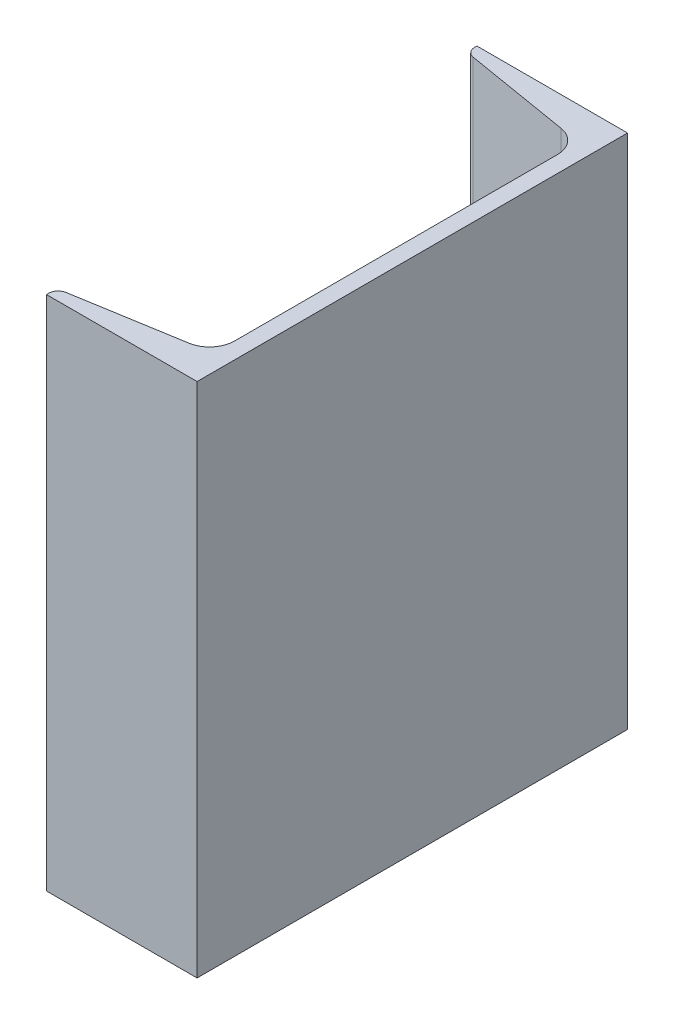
SolidWorks part; units mm, degrees
ref_plane "Front Plane" through (0, 0, 0) normal (0, 0, 1) x (1, 0, 0)
ref_plane "Top Plane" through (0, 0, 0) normal (0, 1, 0) x (1, 0, 0)
ref_plane "Right Plane" through (0, 0, 0) normal (1, 0, 0) x (0, 0, -1)
sketch "Sketch1" plane through (0, 0, 0) normal (0, 0, 1) x (1, 0, 0)
  line L0 (0, 0) -> (0, 152.4)
  dimension "D1" = 152.4
other "Al channel (standard) C5X2.32(1)"
ref_plane "Plane1" through (0, 0, 0) normal (0, 1, 0) x (-1, 0, 0)
sketch "Sketch12" plane through (0, 0, 0) normal (0, 1, 0) x (-1, 0, 0)
  line L0 (0, 0) -> (0, 127)
  line L1 (0, 127) -> (44.45, 127)
  line L2 (0, 0) -> (44.45, 0)
  line L5 (0, 63.5) -> (4.826, 63.5) construction
  line L12 (4.826, 111.125) -> (4.826, 15.875)
  line L15 (44.45, 127) -> (44.45, 126.3362)
  line L16 (44.45, 0) -> (44.45, 0.6638)
  line L17 (10.981, 118.3908) -> (42.1154, 123.5802)
  line L18 (10.981, 8.6092) -> (42.1154, 3.4198)
  arc A9 (4.826, 15.875) -> (10.981, 8.6092) centre (12.192, 15.875) ccw
  arc A10 (4.826, 111.125) -> (10.981, 118.3908) centre (12.192, 111.125) cw
  arc A11 (44.45, 126.3362) -> (42.1154, 123.5802) centre (41.656, 126.3362) cw
  arc A12 (44.45, 0.6638) -> (42.1154, 3.4198) centre (41.656, 0.6638) ccw
  point P4 (22.225, 127)
  point P5 (22.225, 0)
  point P8 (0, 0)
  dimension "RI" = 7.366
  dimension "D2" = 9.463
  dimension "RA" = 2.794
  dimension "DEPTH" = 127
  dimension "BF" = 44.45
  dimension "TW" = 4.826
  dimension "d1" = 95.25
